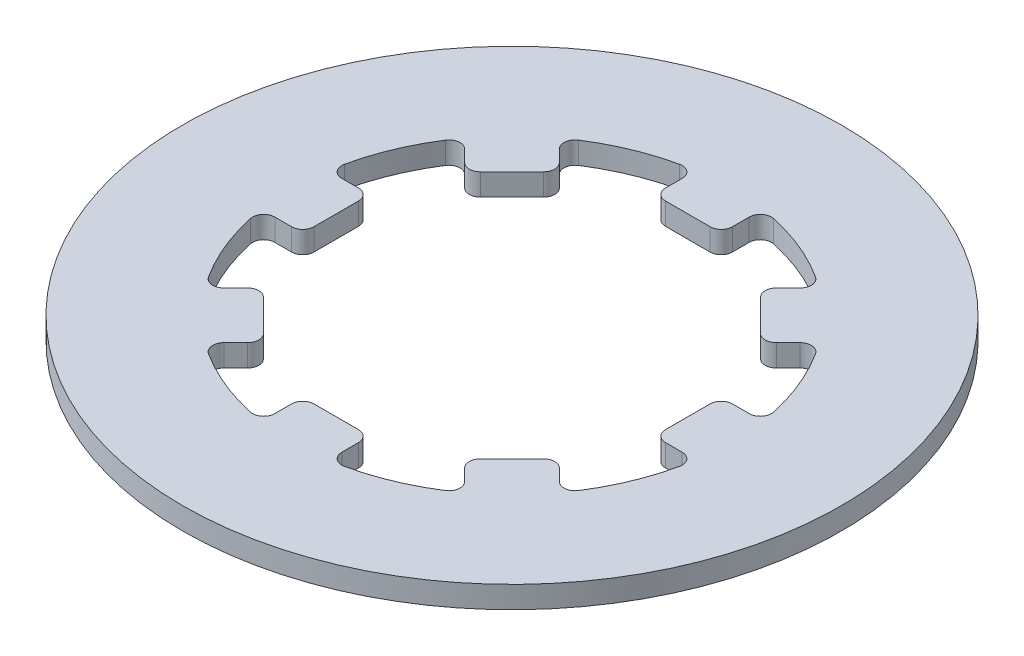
SolidWorks part; units mm, degrees
ref_plane "Front Plane" through (0, 0, 0) normal (0, 0, 1) x (1, 0, 0)
ref_plane "Top Plane" through (0, 0, 0) normal (0, 1, 0) x (1, 0, 0)
ref_plane "Right Plane" through (0, 0, 0) normal (1, 0, 0) x (0, 0, -1)
sketch "Sketch1" plane through (0, 0, 0) normal (0, 1, 0) x (1, 0, 0)
  line L0 (-0.762, 4.9416) -> (-0.762, 4)
  line L1 (-0.762, 4) -> (0.762, 4)
  line L2 (0.762, 4) -> (0.762, 4.9416)
  line L3 (2.9554, 4.0331) -> (2.2896, 3.3672)
  line L4 (2.2896, 3.3672) -> (3.3672, 2.2896)
  line L5 (3.3672, 2.2896) -> (4.0331, 2.9554)
  line L6 (4.9416, 0.762) -> (4, 0.762)
  line L7 (4, 0.762) -> (4, -0.762)
  line L8 (4, -0.762) -> (4.9416, -0.762)
  line L9 (4.0331, -2.9554) -> (3.3672, -2.2896)
  line L10 (3.3672, -2.2896) -> (2.2896, -3.3672)
  line L11 (2.2896, -3.3672) -> (2.9554, -4.0331)
  line L12 (0.762, -4.9416) -> (0.762, -4)
  line L13 (0.762, -4) -> (-0.762, -4)
  line L14 (-0.762, -4) -> (-0.762, -4.9416)
  line L15 (-2.9554, -4.0331) -> (-2.2896, -3.3672)
  line L16 (-2.2896, -3.3672) -> (-3.3672, -2.2896)
  line L17 (-3.3672, -2.2896) -> (-4.0331, -2.9554)
  line L18 (-4.9416, -0.762) -> (-4, -0.762)
  line L19 (-4, -0.762) -> (-4, 0.762)
  line L20 (-4, 0.762) -> (-4.9416, 0.762)
  line L21 (-4.0331, 2.9554) -> (-3.3672, 2.2896)
  line L22 (-3.3672, 2.2896) -> (-2.2896, 3.3672)
  line L23 (-2.2896, 3.3672) -> (-2.9554, 4.0331)
  arc A0 (-4.0331, 2.9554) -> (-4.9416, 0.762) centre (0, 0) ccw
  circle A1 centre (0, 0) radius 7.5
  arc A2 (-0.762, 4.9416) -> (-2.9554, 4.0331) centre (0, 0) ccw
  arc A3 (2.9554, 4.0331) -> (0.762, 4.9416) centre (0, 0) ccw
  arc A4 (4.9416, 0.762) -> (4.0331, 2.9554) centre (0, 0) ccw
  arc A5 (4.0331, -2.9554) -> (4.9416, -0.762) centre (0, 0) ccw
  arc A6 (0.762, -4.9416) -> (2.9554, -4.0331) centre (0, 0) ccw
  arc A7 (-2.9554, -4.0331) -> (-0.762, -4.9416) centre (0, 0) ccw
  arc A8 (-4.9416, -0.762) -> (-4.0331, -2.9554) centre (0, 0) ccw
  point P6 (2.1559, 3.175)
  point P9 (0, 0)
  point P39 (0, 0)
  dimension "D1" = 15
  dimension "D2" = 10
  dimension "D3" = 4
  dimension "D4" = 1.524
  dimension "D5" = 8
extrude "Boss-Extrude1" add sketch "Sketch1" along normal blind 0.5
fillet "Fillet2" radius 0.254 32 edges at (4.9416, 0.25, -0.762) (4, 0.25, -0.762) (4, 0.25, 0.762) (4.9416, 0.25, 0.762) (3.3672, 0.25, 2.2896) (4.0331, 0.25, 2.9554) (2.9554, 0.25, 4.0331) (0.762, 0.25, 4.9416) (2.2896, 0.25, 3.3672) (0.762, 0.25, 4) (-0.762, 0.25, 4) (-0.762, 0.25, 4.9416) (-2.9554, 0.25, 4.0331) (-2.2896, 0.25, 3.3672) (-3.3672, 0.25, 2.2896) (-4.0331, 0.25, 2.9554) (-4.9416, 0.25, 0.762) (-4, 0.25, 0.762) (-4, 0.25, -0.762) (-4.9416, 0.25, -0.762) (-4.0331, 0.25, -2.9554) (-2.2896, 0.25, -3.3672) (-3.3672, 0.25, -2.2896) (4.0331, 0.25, -2.9554) (2.9554, 0.25, -4.0331) (0.762, 0.25, -4.9416) (3.3672, 0.25, -2.2896) (2.2896, 0.25, -3.3672) (0.762, 0.25, -4) (-0.762, 0.25, -4) (-0.762, 0.25, -4.9416) (-2.9554, 0.25, -4.0331)
